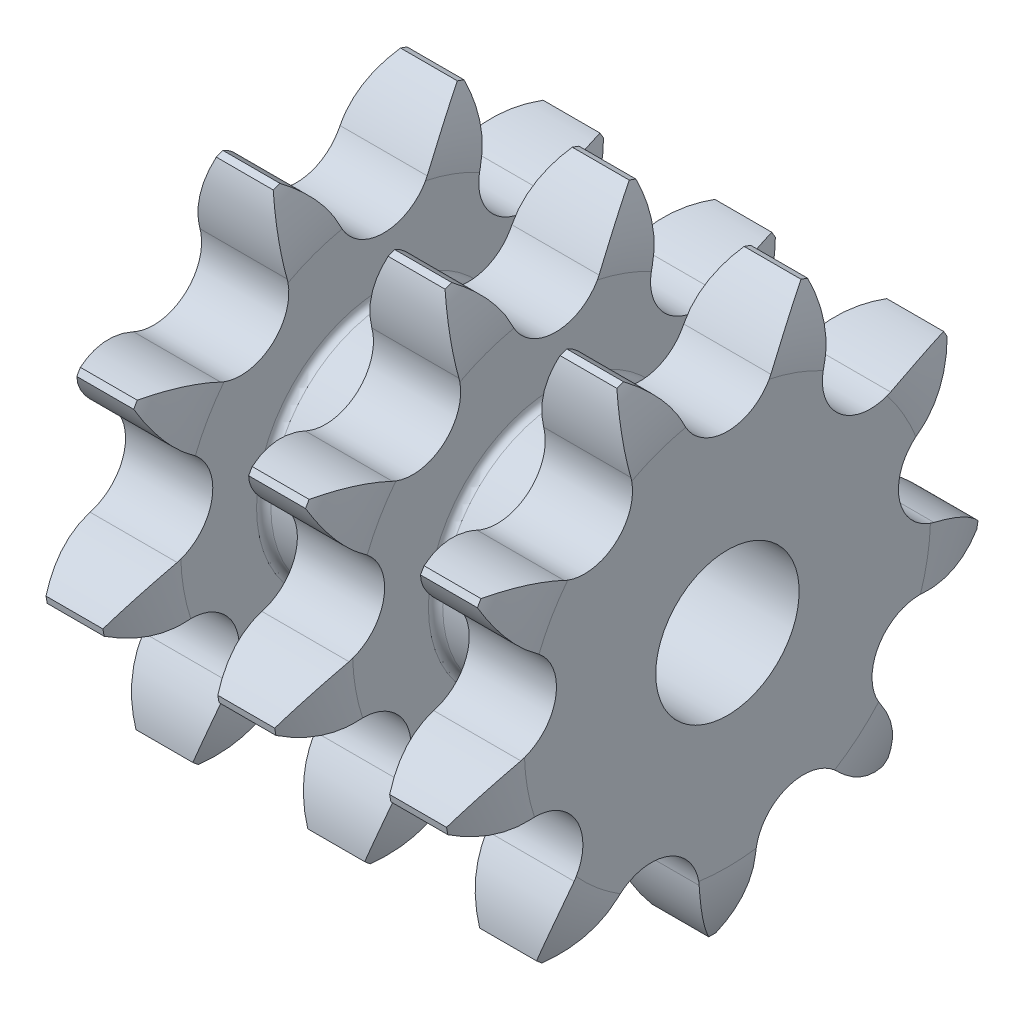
SolidWorks part; units mm, degrees
ref_plane "Plane1" through (0, 0, 0) normal (0, 0, 1) x (1, 0, 0)
ref_plane "Plane2" through (0, 0, 0) normal (0, 1, 0) x (1, 0, 0)
ref_plane "Plane3" through (0, 0, 0) normal (1, 0, 0) x (0, 0, -1)
sketch "Clipboard" plane through (0, 0, 0) normal (0, 1, 0) x (1, 0, 0)
  line L0 (0, 0) -> (12.5436, -1.9867)
  line L1 (-15, 0) -> (100, 0) construction
  line L2 (0, 0) -> (-0.8416, 0.9512)
  line L3 (0, 0) -> (-11.863, 4.5341)
  line L4 (0, 0) -> (3.0618, 0.4849)
  line L5 (0, 0) -> (-2.8109, -1.0484)
  line L6 (0, 0) -> (-29.8924, -20.1685)
  line L7 (-0.8416, 0.9512) -> (36.5829, 8.906)
  line L8 (-76.2, 38.1) -> (-75.2, 38.1)
  line L9 (-73.4321, 41.7084) -> (-72.837, 41.7846)
  line L10 (-73.4741, 12.9512) -> (-59.0941, 12.9512)
  circle A0 centre (0, 0) radius 3.975
  circle A1 centre (0, 0) radius 10.0465
  circle A2 centre (0, 0) radius 25
  dimension "Dr" = 7.95
  dimension "MHD" = 20.093
  dimension "Hub_dia" = 50
  dimension "Num_teeth" = 9
  dimension "Pitch" = 12.7
  dimension "Width" = 3.1
  dimension "Side_relief" = 1.27
  dimension "Side_radius" = 12.7
  dimension "Overall_len" = 3
  dimension "Show_teeth" = 9
  dimension "Thickness" = 36.06
  dimension "OAL" = 38.2605
  dimension "T_dim" = 1
  dimension "Fillet_rad" = 0.6
  dimension "Face_width" = 7.3
  dimension "Num_strands" = 3
  dimension "Transv_pitch" = 14.38
  dimension "Plate_wid" = 12
sketch "BasProSke" plane through (0, 0, 0) normal (0, 1, 0) x (1, 0, 0)
  line L0 (-10, 0) -> (60, 0) construction
  line L1 (0, 0) -> (0, 16.9929)
  line L2 (0, 0) -> (36.06, 0)
  line L3 (36.06, 0) -> (36.06, 16.9929)
  line L4 (34.79, 22.5287) -> (1.27, 22.5287)
  arc A0 (0, 16.9929) -> (1.27, 22.5287) centre (12.7, 16.9929) cw
  arc A1 (36.06, 16.9929) -> (34.79, 22.5287) centre (23.36, 16.9929) ccw
  dimension "D1" = 12.7
  dimension "G1" = 1.27
  dimension "G2" = 1.27
  dimension "Diameter" = 45.0573
  dimension "Thickness" = 36.06
revolve "Base-Revolve" add sketch "BasProSke" angle 360 about L0
sketch "GrvSke" plane through (0, 0, 0) normal (0, 1, 0) x (1, 0, 0)
  line L0 (7.3, 16.9929) -> (7.3, 10.6465)
  line L1 (7.9, 10.0465) -> (13.78, 10.0465)
  line L2 (14.38, 10.6465) -> (14.38, 16.9929)
  line L3 (6.03, 22.5287) -> (15.65, 22.5287)
  line L4 (10.84, 0) -> (10.84, 52.07) construction
  line L5 (-10, 0) -> (60, 0) construction
  line L6 (0, 0) -> (35.56, 0) construction
  arc A0 (14.38, 16.9929) -> (15.65, 22.5287) centre (27.08, 16.9929) cw
  arc A1 (7.3, 16.9929) -> (6.03, 22.5287) centre (-5.4, 16.9929) ccw
  arc A2 (7.3, 10.6465) -> (7.9, 10.0465) centre (7.9, 10.6465) ccw
  arc A3 (13.78, 10.0465) -> (14.38, 10.6465) centre (13.78, 10.6465) ccw
  dimension "D1" = 12.7
  dimension "Fillet_rad" = 0.6
  dimension "Diameter" = 45.0573
  dimension "Grv_diam" = 20.093
  dimension "Grv_width" = 7.08
  dimension "Offset" = 10.84
  dimension "G1" = 1.27
revolve "Groove" cut sketch "GrvSke" angle 360 about L6
pattern_linear "Grooves" count 2 spacing 14.38 along (1, 0, 0) of "Groove"
sketch "TooCutSke" plane through (0, 0, 0) normal (1, 0, 0) x (0, 0, -1)
  line L0 (0, 18.6059) -> (3.6386, 16.9092) construction
  line L1 (0, 0) -> (0, 107) construction
  line L2 (0, 18.6059) -> (-10, 18.6059) construction
  line L3 (0, 18.6059) -> (-3.6386, 16.9092) construction
  arc A0 (3.6386, 16.9092) -> (7.9748, 21.6037) centre (13.1494, 12.4742) cw
  arc A1 (3.6386, 16.9092) -> (-3.6386, 16.9092) centre (0, 18.6059) cw
  arc A2 (-3.6386, 16.9092) -> (-7.9748, 21.6037) centre (-13.1494, 12.4742) ccw
  arc A3 (7.9748, 21.6037) -> (-7.9748, 21.6037) centre (0, 0) ccw
  dimension "R1" = 4.0148
  dimension "R2" = 10.494
  dimension "Overcut" = 23.0287
  dimension "Seat_radius" = 18.6059
  dimension "X" = 130
extrude "ToothCut" cut sketch "TooCutSke" along normal through all
pattern_circular "TeethCuts" count 9 every 40 about axis through (-10, 0, 0) along (1, 0, 0) of "ToothCut"
sketch "HubNeaOneSke" plane through (0, 0, 0) normal (-1, 0, 0) x (0, 0, 1)
  circle A0 centre (0, 0) radius 10.0465
  dimension "Diameter" = 20.093
extrude "HubNearOne" [suppressed] add sketch "HubNeaOneSke" along normal blind 2.2005
fillet "HubNearOneFillet" [suppressed] radius 0.6
sketch "HubNeaBotSke" plane through (0, 0, 0) normal (-1, 0, 0) x (0, 0, 1)
  circle A0 centre (0, 0) radius 10.0465
  dimension "Diameter" = 20.093
extrude "HubNearBoth" [suppressed] add sketch "HubNeaBotSke" along normal blind 1.1003
fillet "HubNearBothFillet" [suppressed] radius 0.6
ref_plane "FarPln" through (36.06, 0, 0) normal (1, 0, 0) x (0, 0, -1)
sketch "HubFarSke" plane through (36.06, 0, 0) normal (1, 0, 0) x (0, 0, -1)
  circle A0 centre (0, 0) radius 10.0465
  dimension "Diameter" = 20.093
extrude "HubFar" [suppressed] add sketch "HubFarSke" along normal blind 1.1003
fillet "HubFarFillet" [suppressed] radius 0.6
sketch "BorSke" plane through (0, 0, 0) normal (1, 0, 0) x (0, 0, -1)
  circle A0 centre (0, 0) radius 6
  dimension "Diameter" = 12
extrude "Bore" cut sketch "BorSke" along normal mid plane 76.521
sketch "KeySke" plane through (0, 0, 0) normal (1, 0, 0) x (0, 0, -1)
  line L0 (-1, 0) -> (-1, 7)
  line L1 (-1, 7) -> (1, 7)
  line L2 (1, 7) -> (1, 0)
  line L3 (0, 0) -> (0, 34) construction
  line L4 (-1, 0) -> (1, 0)
  dimension "Offset" = 7
  dimension "Width" = 2
extrude "Keyway" [suppressed] cut sketch "KeySke" along normal mid plane 76.521
pattern_circular "Keyway2" [suppressed] count 2 every 90 about axis through (-10, 0, 0) along (1, 0, 0)
equation "' \"Pitch@Clipboard\" = 12.7"
equation "' \"Num_strands@Clipboard\" = 3"
equation "' \"Num_teeth@Clipboard\" = 9"
equation "' \"Hub_dia@Clipboard\" = 50"
equation "' \"Overall_len@Clipboard\" = 3"
equation "' \"Diameter@BorSke\" = 12"
equation "' \"T_dim@Clipboard\" = 1"
equation "' \"Width@KeySke\" = 2"
equation "' \"Dr@Clipboard\" = 7.95"
equation "' \"Face_width@Clipboard\" = 7.3"
equation "' \"Side_radius@Clipboard\" = 12.7"
equation "' \"Side_relief@Clipboard\" = 1.27"
equation "' \"Transv_pitch@Clipboard\" = 14.38"
equation "' \"Show_teeth@Clipboard\" = 9"
equation "' \"Fillet_rad@Clipboard\" = 0.6"
equation "' \"Plate_wid@Clipboard\" = 12"
equation "\"Num_teeth@Clipboard\" = int( \"Num_teeth@Clipboard\" )"
equation "\"Num_teeth@Clipboard\" = ((sgn( \"Num_teeth@Clipboard\" - 5.0)+1)*( \"Num_teeth@Clipboard\" - 5.0))/2 +5.0"
equation "\"Num_teeth@Clipboard\" = ((sgn( \"Num_teeth@Clipboard\" - 200.0)-1)*( \"Num_teeth@Clipboard\" - 200.0))/-2 +200.0"
equation "\"MHD@Clipboard\" = \"Pitch@Clipboard\" * (1.0 / tan(3.14159265 / \"Num_teeth@Clipboard\" )) - 1.05 * \"Plate_wid@Clipboard\" - 2.0 * \"Fillet_rad@Clipboard\" - 1.0"
equation "\"Thickness@Clipboard\"  = \"Face_width@Clipboard\" + (\"Num_strands@Clipboard\" - 1) * \"Transv_pitch@Clipboard\""
equation "\"OAL@Clipboard\" = \"Thickness@Clipboard\" + 2 * \"Fillet_rad@Clipboard\" + 1"
equation "\"MHD@Clipboard\" = ((sgn( \"MHD@Clipboard\" - \"Hub_dia@Clipboard\" )-1)*( \"MHD@Clipboard\" - \"Hub_dia@Clipboard\" ))/-2+ \"Hub_dia@Clipboard\""
equation "\"OAL@Clipboard\" = ((sgn( \"OAL@Clipboard\" - \"Overall_len@Clipboard\" )+1)*( \"OAL@Clipboard\" - \"Overall_len@Clipboard\" ))/2 + \"Overall_len@Clipboard\" + 0.0005"
equation "\"Num_teeth@TeethCuts\" = int( \"Show_teeth@Clipboard\" ) + 1"
equation "\"Num_teeth@TeethCuts\" = ((sgn( \"Num_teeth@TeethCuts\" - \"Num_teeth@Clipboard\" )-1)*( \"Num_teeth@TeethCuts\" - \"Num_teeth@Clipboard\" ))/-2+ \"Num_teeth@Clipboard\""
equation "\"Num_teeth@TeethCuts\" = ((sgn( \"Num_teeth@TeethCuts\" - 2.0)+1)*( \"Num_teeth@TeethCuts\" - 2.0))/2 +2.0"
equation "\"Angle@TeethCuts\" = 360.0 / \"Num_teeth@Clipboard\""
equation "\"Seat_radius@TooCutSke\" = ( \"Pitch@Clipboard\" / 2.0) / sin(3.14159265 / \"Num_teeth@Clipboard\" ) - \"Dr@Clipboard\" / 2.0 + \"Dr@Clipboard\" * 0.505"
equation "\"R1@TooCutSke\"  = \"Dr@Clipboard\" * 0.505"
equation "\"X@TooCutSke\" = 140.0 - (90.0 / \"Num_teeth@Clipboard\")"
equation "\"R2@TooCutSke\" = 0.12 * \"Dr@Clipboard\" * ( \"Num_teeth@Clipboard\" + 2.0)"
equation "\"Overcut@TooCutSke\" = 0.5 + 0.625 * \"Pitch@Clipboard\" - 0.5 * \"Dr@Clipboard\"  +  \"Pitch@Clipboard\" / 2.0 / sin(3.14159265 / \"Num_teeth@Clipboard\" )"
equation "\"Diameter@BasProSke\" = 2.0 * ( 0.625 * \"Pitch@Clipboard\" - 0.5 * \"Dr@Clipboard\"  +  \"Pitch@Clipboard\" / 2.0 / sin(3.14159265 / \"Num_teeth@Clipboard\" ))"
equation "\"Thickness@BasProSke\"  = \"Thickness@Clipboard\""
equation "\"G1@BasProSke\" =  \"Side_relief@Clipboard\""
equation "\"G2@BasProSke\" =  \"Side_relief@Clipboard\""
equation "\"D1@BasProSke\" =  \"Side_radius@Clipboard\""
equation "\"Diameter@GrvSke\" = \"Diameter@BasProSke\""
equation "\"G1@GrvSke\" = \"Side_relief@Clipboard\""
equation "\"D1@GrvSke\" = \"Side_radius@Clipboard\""
equation "\"Grv_diam@GrvSke\" =  \"Pitch@Clipboard\" * (1.0 / tan(3.14159265 / \"Num_teeth@Clipboard\" ))- 1.05 * \"Plate_wid@Clipboard\" - 2.0 * \"Fillet_rad@Clipboard\" - 1.0"
equation "\"Grv_width@GrvSke\" =  \"Transv_pitch@Clipboard\" - \"Face_width@Clipboard\""
equation "\"Offset@GrvSke\" = \"Grv_width@GrvSke\" / 2.0 + \"Face_width@Clipboard\""
equation "\"Fillet_rad@GrvSke\" = \"Fillet_rad@Clipboard\""
equation "\"Offset@Grooves\" = \"Transv_pitch@Clipboard\""
equation "\"Num_grvs@Grooves\" = \"Num_strands@Clipboard\""
equation "\"Num_grvs@Grooves\" = \"Num_grvs@Grooves\" - 1 * sgn( \"Num_grvs@Grooves\" -1)"
equation "\"Diameter@HubNeaOneSke\" = \"MHD@Clipboard\""
equation "\"Length@HubNearOne\" = \"OAL@Clipboard\" - \"Thickness@BasProSke\""
equation "\"Diameter@HubNeaBotSke\" = \"MHD@Clipboard\""
equation "\"Length@HubNearBoth\" = ( \"OAL@Clipboard\" - \"Thickness@BasProSke\" ) / 2.0"
equation "\"D1@HubNearOneFillet\" = \"Fillet_rad@Clipboard\""
equation "\"D1@HubNearBothFillet\" = \"Fillet_rad@Clipboard\""
equation "\"Thickness@FarPln\" = \"Thickness@BasProSke\""
equation "\"Diameter@HubFarSke\" = \"MHD@Clipboard\""
equation "\"Length@HubFar\" = ( \"OAL@Clipboard\" - \"Thickness@BasProSke\" ) / 2.0"
equation "\"D1@HubFarFillet\" = \"Fillet_rad@Clipboard\""
equation "\"D1@Bore\" = \"OAL@Clipboard\" * 2.0"
equation "\"D1@Keyway\" = \"OAL@Clipboard\" * 2.0"
equation "\"Offset@KeySke\" = \"T_dim@Clipboard\" + \"Diameter@BorSke\" / 2.0"
